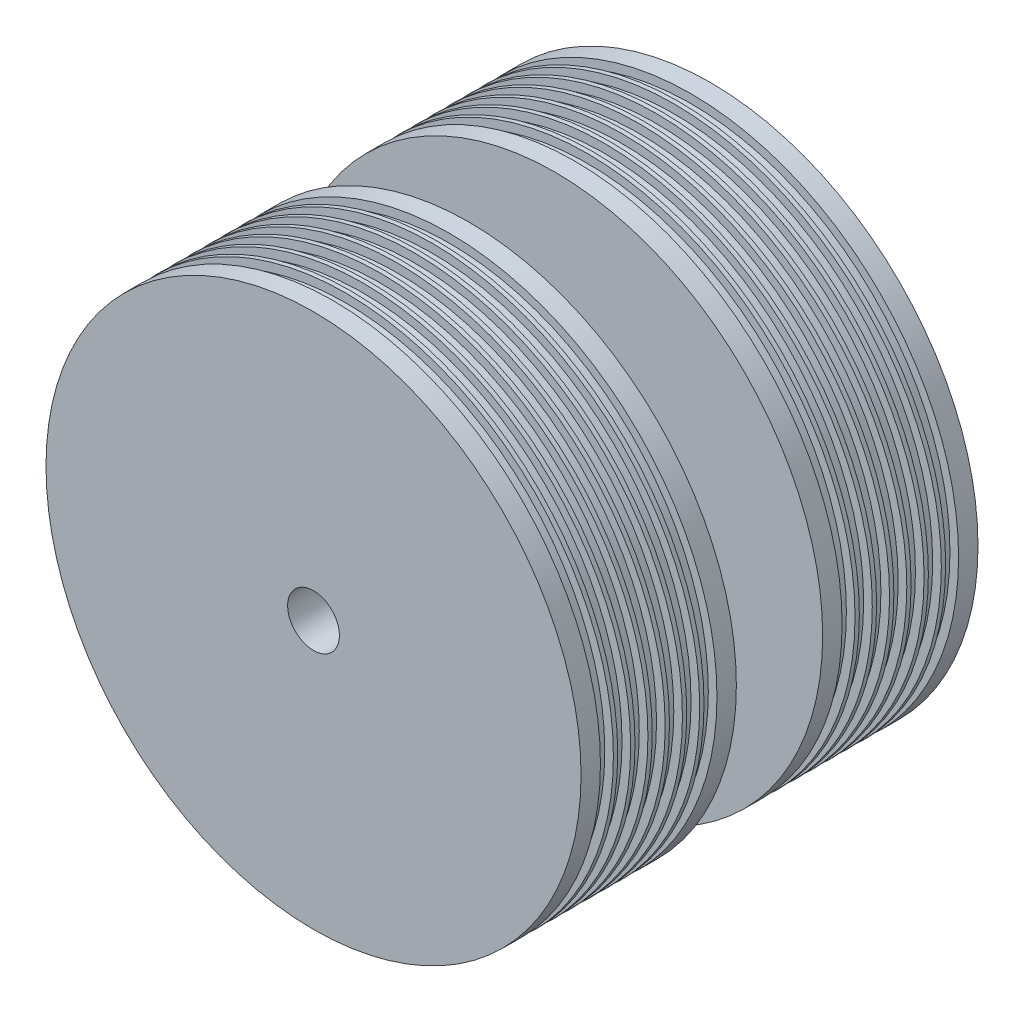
SolidWorks part; units mm, degrees
ref_plane "Front Plane" through (0, 0, 0) normal (0, 0, 1) x (1, 0, 0)
ref_plane "Top Plane" through (0, 0, 0) normal (0, 1, 0) x (1, 0, 0)
ref_plane "Right Plane" through (0, 0, 0) normal (1, 0, 0) x (0, 0, -1)
sketch "Sketch1" plane through (0, 0, 0) normal (0, 1, 0) x (1, 0, 0)
  line L0 (15.5, 20.875) -> (15.5, 20.125)
  line L1 (0, 0) -> (15.5, 0)
  line L2 (0, 0) -> (0, 23)
  line L3 (0, 23) -> (15.5, 23)
  line L4 (15.5, 0) -> (15.5, 23)
  line L5 (0, 23) -> (1.5, 23)
  line L6 (0, 23) -> (0, 0)
  line L7 (0, 0) -> (1.5, 0)
  line L8 (1.5, 23) -> (1.5, 0)
  line L9 (15.5, 21.875) -> (15, 21.875)
  line L10 (15.5, 21.875) -> (15.5, 21.125)
  line L11 (15.5, 21.125) -> (15, 21.125)
  line L12 (15, 21.875) -> (15, 21.125)
  line L13 (15.5, 20.875) -> (15, 20.875)
  line L14 (15, 20.875) -> (15, 20.125)
  line L15 (15.5, 20.125) -> (15, 20.125)
  line L16 (15.5, 19.875) -> (15.5, 19.125)
  line L17 (15.5, 19.875) -> (15, 19.875)
  line L18 (15, 19.875) -> (15, 19.125)
  line L19 (15.5, 19.125) -> (15, 19.125)
  line L20 (15.5, 18.875) -> (15.5, 18.125)
  line L21 (15.5, 18.875) -> (15, 18.875)
  line L22 (15, 18.875) -> (15, 18.125)
  line L23 (15.5, 18.125) -> (15, 18.125)
  line L24 (15.5, 17.875) -> (15.5, 17.125)
  line L25 (15.5, 17.875) -> (15, 17.875)
  line L26 (15, 17.875) -> (15, 17.125)
  line L27 (15.5, 17.125) -> (15, 17.125)
  line L28 (15.5, 16.875) -> (15.5, 16.125)
  line L29 (15.5, 16.875) -> (15, 16.875)
  line L30 (15, 16.875) -> (15, 16.125)
  line L31 (15.5, 16.125) -> (15, 16.125)
  line L32 (15.5, 15.875) -> (15.5, 15.125)
  line L33 (15.5, 15.875) -> (15, 15.875)
  line L34 (15, 15.875) -> (15, 15.125)
  line L35 (15.5, 15.125) -> (15, 15.125)
  line L36 (15.5, 14.875) -> (15.5, 14.125)
  line L37 (15.5, 14.875) -> (15, 14.875)
  line L38 (15, 14.875) -> (15, 14.125)
  line L39 (15.5, 14.125) -> (15, 14.125)
  line L40 (15.5, 13.875) -> (15.5, 13.125)
  line L41 (15.5, 13.875) -> (15, 13.875)
  line L42 (15, 13.875) -> (15, 13.125)
  line L43 (15.5, 13.125) -> (15, 13.125)
  line L44 (15.5, 12.875) -> (15.5, 12.125)
  line L45 (15.5, 12.875) -> (15, 12.875)
  line L46 (15, 12.875) -> (15, 12.125)
  line L47 (15.5, 12.125) -> (15, 12.125)
  line L48 (15.5, 11.875) -> (15.5, 11.125)
  line L49 (15.5, 11.875) -> (15, 11.875)
  line L50 (15, 11.875) -> (15, 11.125)
  line L51 (15.5, 11.125) -> (15, 11.125)
  line L52 (15.5, 10.875) -> (15.5, 10.125)
  line L53 (15.5, 10.875) -> (15, 10.875)
  line L54 (15, 10.875) -> (15, 10.125)
  line L55 (15.5, 10.125) -> (15, 10.125)
  line L56 (15.5, 9.875) -> (15.5, 9.125)
  line L57 (15.5, 9.875) -> (15, 9.875)
  line L58 (15, 9.875) -> (15, 9.125)
  line L59 (15.5, 9.125) -> (15, 9.125)
  line L60 (15.5, 8.875) -> (15.5, 8.125)
  line L61 (15.5, 8.875) -> (15, 8.875)
  line L62 (15, 8.875) -> (15, 8.125)
  line L63 (15.5, 8.125) -> (15, 8.125)
  line L64 (15.5, 7.875) -> (15.5, 7.125)
  line L65 (15.5, 7.875) -> (15, 7.875)
  line L66 (15, 7.875) -> (15, 7.125)
  line L67 (15.5, 7.125) -> (15, 7.125)
  line L68 (15.5, 6.875) -> (15.5, 6.125)
  line L69 (15.5, 6.875) -> (15, 6.875)
  line L70 (15, 6.875) -> (15, 6.125)
  line L71 (15.5, 6.125) -> (15, 6.125)
  line L72 (15.5, 5.875) -> (15.5, 5.125)
  line L73 (15.5, 5.875) -> (15, 5.875)
  line L74 (15, 5.875) -> (15, 5.125)
  line L75 (15.5, 5.125) -> (15, 5.125)
  line L76 (15.5, 4.875) -> (15.5, 4.125)
  line L77 (15.5, 4.875) -> (15, 4.875)
  line L78 (15, 4.875) -> (15, 4.125)
  line L79 (15.5, 4.125) -> (15, 4.125)
  line L80 (15.5, 3.875) -> (15.5, 3.125)
  line L81 (15.5, 3.875) -> (15, 3.875)
  line L82 (15, 3.875) -> (15, 3.125)
  line L83 (15.5, 3.125) -> (15, 3.125)
  line L84 (15.5, 2.875) -> (15.5, 2.125)
  line L85 (15.5, 2.875) -> (15, 2.875)
  line L86 (15, 2.875) -> (15, 2.125)
  line L87 (15.5, 2.125) -> (15, 2.125)
  line L88 (15.5, 1.875) -> (15.5, 1.125)
  line L89 (15.5, 1.875) -> (15, 1.875)
  line L90 (15, 1.875) -> (15, 1.125)
  line L91 (15.5, 1.125) -> (15, 1.125)
  line L92 (15.5, 0.875) -> (15.5, 0.125)
  line L93 (0, 14) -> (15.5, 14)
  line L94 (0, 14) -> (0, 9)
  line L95 (0, 9) -> (15.5, 9)
  line L96 (15.5, 14) -> (15.5, 9)
  line L97 (15.5, 0.875) -> (15, 0.875)
  line L98 (15, 0.875) -> (15, 0.125)
  line L99 (15.5, 0.125) -> (15, 0.125)
  line L100 (15.5, -0.125) -> (15.5, -0.875)
  line L101 (15.5, -0.125) -> (15, -0.125)
  line L102 (15, -0.125) -> (15, -0.875)
  line L103 (15.5, -0.875) -> (15, -0.875)
  dimension "D1" = 15.5
  dimension "D2" = 23
  dimension "D3" = 1.5
  dimension "D4" = 1.125
  dimension "D5" = 0.75
  dimension "D7" = 0.5
  dimension "D8" = 5
  dimension "D9" = 9
  dimension "D6" = 23
revolve "Revolve2" add sketch "Sketch1" angle 360 about L2
